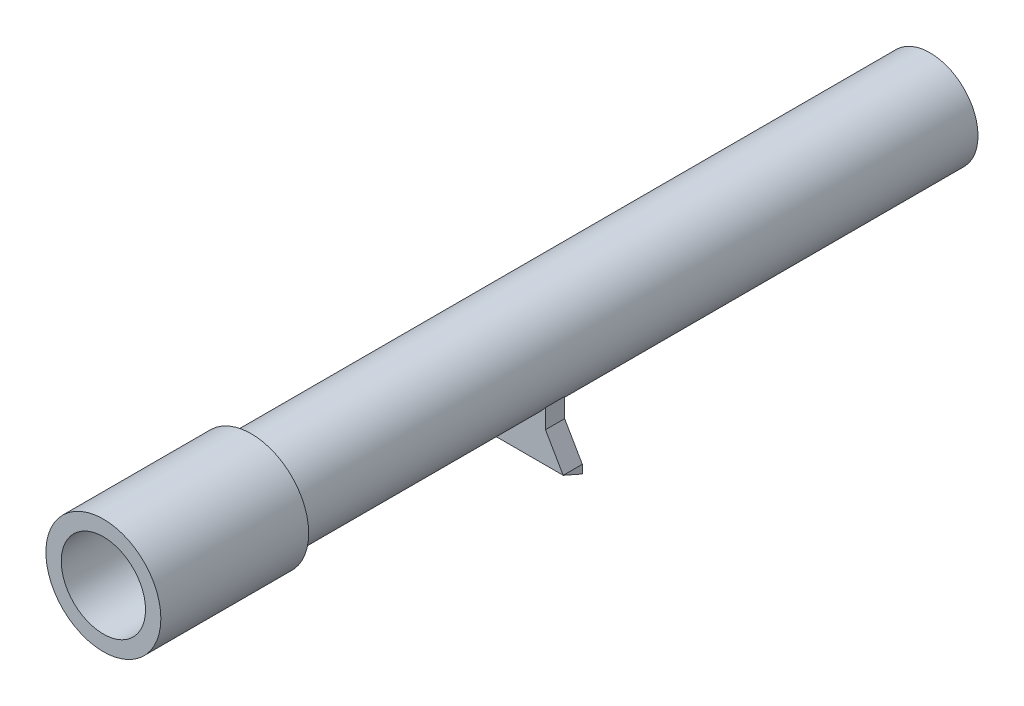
SolidWorks part; units mm, degrees
ref_plane "Front Plane" through (0, 0, 0) normal (0, 0, 1) x (1, 0, 0)
ref_plane "Top Plane" through (0, 0, 0) normal (0, 1, 0) x (1, 0, 0)
ref_plane "Right Plane" through (0, 0, 0) normal (1, 0, 0) x (0, 0, -1)
sketch "Sketch1" plane through (0, 0, 0) normal (0, 0, 1) x (1, 0, 0)
  circle A0 centre (0, 0) radius 15.875
  dimension "D1" = 31.75
extrude "Boss-Extrude1" add sketch "Sketch1" along normal blind 225
sketch "Sketch2" plane through (0, 0, 225) normal (0, 0, 1) x (1, 0, 0)
  circle A0 centre (0, 0) radius 19.05
  dimension "D1" = 38.1
extrude "Boss-Extrude2" add sketch "Sketch2" along normal blind 49
ref_plane "Plane1" through (0, 0, 137) normal (0, 0, -1) x (-1, 0, 0)
sketch "Sketch4" plane through (0, 0, 137) normal (0, 0, -1) x (-1, 0, 0)
  line L1 (-12.7, -9.525) -> (12.7, -9.525)
  line L2 (-12.7, -9.525) -> (-12.7, -15.875)
  line L3 (-12.7, -15.875) -> (12.7, -15.875)
  line L4 (12.7, -9.525) -> (12.7, -15.875)
  circle A0 centre (0, 0) radius 15.875 construction
  circle A1 centre (0, 0) radius 15.875 construction
  point P9 (0, -15.875)
  dimension "D1" = 6.35
extrude "Boss-Extrude3" add sketch "Sketch4" along normal mid plane 6.35
sketch "Sketch5" plane through (0, 0, 133.825) normal (0, 0, -1) x (-1, 0, 0)
  line L0 (-12.7, -15.875) -> (-18.5659, -26.035)
  line L1 (-18.5659, -26.035) -> (18.5659, -26.035)
  line L2 (18.5659, -26.035) -> (12.7, -15.875)
  line L3 (0, -15.875) -> (12.7, -15.875) construction
  line L4 (-12.7, -15.875) -> (12.7, -15.875)
  line L5 (12.7, -15.875) -> (12.7, -9.525) construction
  dimension "D1" = 60
  dimension "D2" = 60
  dimension "D4" = 10.16
extrude "Boss-Extrude4" add sketch "Sketch5" against normal up to surface (6.35 mm away)
sketch "Sketch6" plane through (0, 0, 274) normal (0, 0, 1) x (1, 0, 0)
  circle A0 centre (0, 0) radius 13.97
  dimension "D1" = 27.94
extrude "Cut-Extrude1" cut sketch "Sketch6" against normal blind 20
sketch "Sketch8" plane through (12.7, 0, 0) normal (1, 0, 0) x (0, 0, -1)
  line L0 (-140.175, -26.035) -> (-133.825, -28.8291)
  line L1 (-133.825, -28.8291) -> (-133.825, -26.035)
  line L2 (-133.825, -26.035) -> (-140.175, -26.035)
  dimension "D1" = 23.75
extrude "Boss-Extrude5" add sketch "Sketch8" along normal up to vertex (5.8659 mm away)
sketch "Sketch10" plane through (12.7, 0, 0) normal (-1, 0, 0) x (0, 0, 1)
  line L0 (133.825, -26.035) -> (140.175, -26.035)
  line L1 (140.175, -26.035) -> (133.825, -28.8291)
  line L2 (133.825, -28.8291) -> (133.825, -26.035)
extrude "Boss-Extrude6" add sketch "Sketch10" along normal up to vertex (31.2659 mm away)
